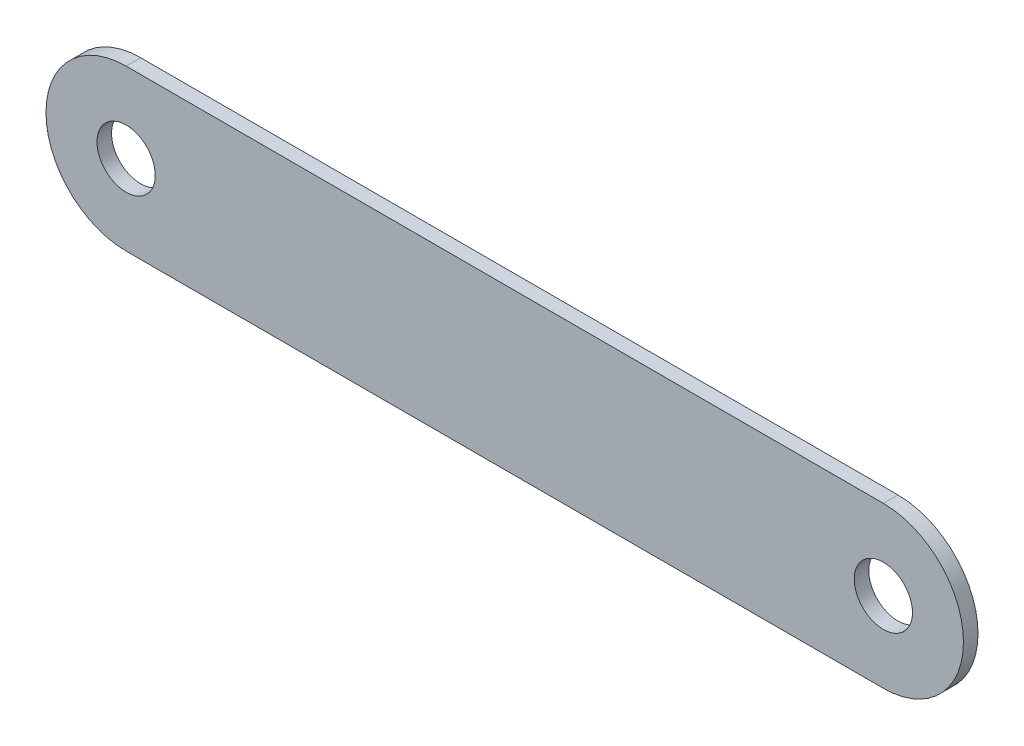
SolidWorks part; units mm, degrees
ref_plane "Face" through (0, 0, 0) normal (0, 0, 1) x (1, 0, 0)
ref_plane "Dessus" through (0, 0, 0) normal (0, 1, 0) x (1, 0, 0)
ref_plane "Droite" through (0, 0, 0) normal (1, 0, 0) x (0, 0, -1)
sketch "Esquisse1" plane through (0, 0, 0) normal (0, 0, 1) x (1, 0, 0)
  line L0 (0, 0) -> (52, 0) construction
  line L1 (0, 5.5) -> (52, 5.5)
  line L2 (52, -5.5) -> (0, -5.5)
  arc A0 (0, 5.5) -> (0, -5.5) centre (0, 0) ccw
  arc A1 (52, -5.5) -> (52, 5.5) centre (52, 0) ccw
  circle A2 centre (52, 0) radius 2
  circle A3 centre (0, 0) radius 2
  dimension "D2" = 11
  dimension "D3" = 11
  dimension "D4" = 4
  dimension "D5" = 4
  dimension "D1" = 52
extrude "Extrusion1" add sketch "Esquisse1" along normal blind 1
